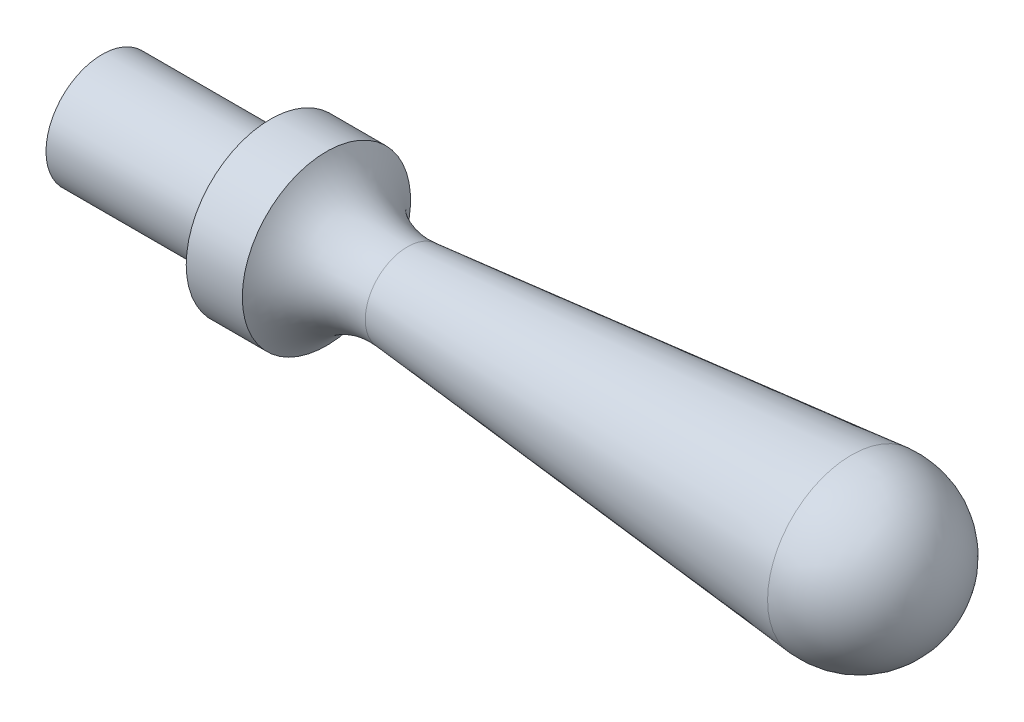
SolidWorks part; units mm, degrees
ref_plane "Front Plane" through (0, 0, 0) normal (0, 0, 1) x (1, 0, 0)
ref_plane "Top Plane" through (0, 0, 0) normal (0, 1, 0) x (1, 0, 0)
ref_plane "Right Plane" through (0, 0, 0) normal (1, 0, 0) x (0, 0, -1)
sketch "Sketch1" plane through (0, 0, 0) normal (0, 0, 1) x (1, 0, 0)
  line L0 (0, 0) -> (100.6943, 0) construction
  line L1 (0, 0) -> (0, 2)
  line L2 (0, 2) -> (6, 2)
  line L3 (6, 2) -> (6, 3)
  line L4 (6, 3) -> (8, 3)
  line L5 (0, 0) -> (30, 0)
  line L6 (10.8861, 1.5) -> (26.7195, 2.9869)
  arc A0 (8, 3) -> (10.8861, 1.5) centre (10.6056, 4.4869) ccw
  arc A2 (26.7195, 2.9869) -> (30, 0) centre (27, 0) cw
  dimension "D5" = 3
  dimension "D8" = 3
  dimension "D1" = 4
  dimension "D2" = 6
  dimension "D3" = 2
  dimension "D4" = 6
  dimension "D7" = 3
  dimension "D9" = 30
revolve "Revolve1" add sketch "Sketch1" angle 360 about L0
